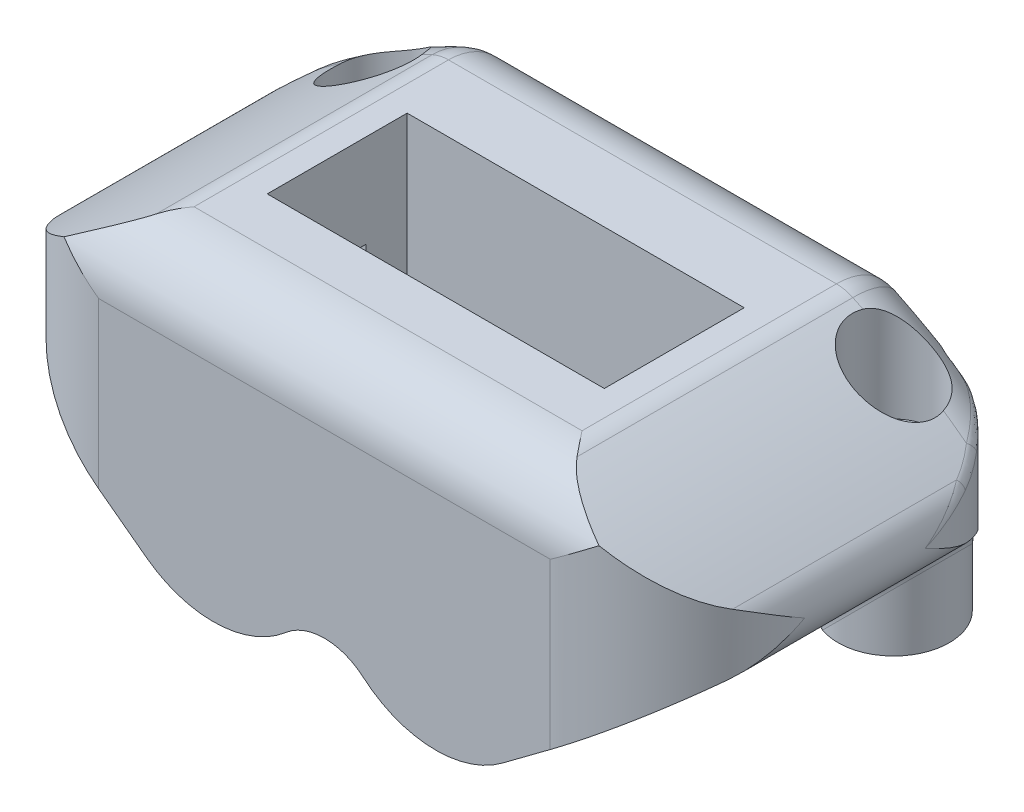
SolidWorks part; units mm, degrees
ref_plane "Plan de face" through (0, 0, 0) normal (0, 0, 1) x (1, 0, 0)
ref_plane "Plan de dessus" through (0, 0, 0) normal (0, 1, 0) x (1, 0, 0)
ref_plane "Plan de droite" through (0, 0, 0) normal (1, 0, 0) x (0, 0, -1)
sketch "Esquisse1" plane through (0, 0, 0) normal (0, 0, 1) x (1, 0, 0)
  line L0 (12.9688, 6.5) -> (99.4276, 6.5) construction
  line L1 (0, 0) -> (111, 0) construction
  line L2 (0, 0) -> (0, 45) construction
  line L4 (111, 0) -> (111, 45) construction
  line L5 (2.4153, 22.1885) -> (27.5448, 3.4665)
  line L6 (25, 45) -> (86, 45)
  line L7 (108.5847, 22.1885) -> (83.4552, 3.4665)
  arc A0 (27.5448, 3.4665) -> (49.424, 4.2432) centre (38, 17.5) ccw
  arc A1 (61.576, 4.2432) -> (83.4552, 3.4665) centre (73, 17.5) ccw
  arc A2 (2.2126, 31.6536) -> (2.4153, 22.1885) centre (6, 27) ccw
  arc A3 (108.5847, 22.1885) -> (108.7874, 31.6536) centre (105, 27) ccw
  arc A4 (61.576, 4.2432) -> (49.424, 4.2432) centre (55.5, -2.8077) ccw
  arc A5 (25, 45) -> (22.4254, 44.4195) centre (25, 39) ccw
  arc A6 (88.5746, 44.4195) -> (86, 45) centre (86, 39) ccw
  arc A7 (22.4254, 44.4195) -> (2.2126, 31.6536) centre (65.3355, -45.9061) ccw
  arc A9 (108.7874, 31.6536) -> (88.5746, 44.4195) centre (45.6645, -45.9061) ccw
  dimension "D5" = 12
  dimension "D6" = 12
  dimension "D7" = 35
  dimension "D8" = 35
  dimension "D9" = 38
  dimension "D10" = 38
  dimension "D12" = 61
  dimension "D13" = 25
  dimension "D14" = 12
  dimension "D15" = 12
  dimension "D16" = 200
  dimension "D17" = 200
  dimension "D19" = 61
  dimension "D2" = 111
  dimension "D3" = 27
  dimension "D4" = 27
  dimension "D11" = 6.5
  dimension "D18" = 45
extrude "Extrusion1" add sketch "Esquisse1" along normal blind 60
sketch "Esquisse2" plane through (0, 45, 0) normal (0, 1, 0) x (1, 0, 0)
  line L0 (-10.9198, -11.5) -> (126.3086, -11.5) construction
  line L2 (22.4254, 0) -> (2.2126, 0) construction
  line L3 (0, 0) -> (0, -60) construction
  circle A0 centre (14.5, -11.5) radius 4.15
  circle A1 centre (96.5, -11.5) radius 4.15
  dimension "D2" = 82
  dimension "D3" = 8.3
  dimension "D4" = 8.3
  dimension "D5" = 14.5
  dimension "D1" = 11.5
extrude "Extrusion2" cut sketch "Esquisse2" against normal blind 60
sketch "Esquisse3" plane through (0, 45, 0) normal (0, 1, 0) x (1, 0, 0)
  circle A0 centre (14.5, -11.5) radius 8.75
  circle A1 centre (96.5, -11.5) radius 8.75
  dimension "D1" = 17.5
  dimension "D2" = 17.5
extrude "Extrusion3" add sketch "Esquisse3" against normal blind 38.5
sketch "Esquisse4" plane through (0, 0, 0) normal (0, 0, -1) x (-1, 0, 0)
  line L4 (-108.5847, 58.5086) -> (-2.4153, 58.5086)
  line L5 (-108.5847, 58.5086) -> (-108.5847, 31.8181)
  line L6 (-25, 45) -> (-86, 45)
  line L7 (-108.5847, 22.1885) -> (-83.4552, 3.4665)
  line L8 (-27.5448, 3.4665) -> (-2.4153, 22.1885)
  line L9 (-25, 45) -> (-86, 45)
  line L13 (-2.4153, 58.5086) -> (-2.4153, 31.8181)
  arc A18 (-2.4153, 22.1885) -> (-2.2126, 31.6536) centre (-6, 27) ccw
  arc A19 (-2.2126, 31.6536) -> (-22.4254, 44.4195) centre (-65.3355, -45.9061) ccw
  arc A20 (-22.4254, 44.4195) -> (-25, 45) centre (-25, 39) ccw
  arc A21 (-86, 45) -> (-88.5746, 44.4195) centre (-86, 39) ccw
  arc A22 (-88.5746, 44.4195) -> (-108.7874, 31.6536) centre (-45.6645, -45.9061) ccw
  arc A23 (-108.7874, 31.6536) -> (-108.5847, 22.1885) centre (-105, 27) ccw
  arc A24 (-83.4552, 3.4665) -> (-61.576, 4.2432) centre (-73, 17.5) ccw
  arc A25 (-49.424, 4.2432) -> (-61.576, 4.2432) centre (-55.5, -2.8077) ccw
  arc A26 (-49.424, 4.2432) -> (-27.5448, 3.4665) centre (-38, 17.5) ccw
  arc A28 (-2.4153, 31.8181) -> (-22.4254, 44.4195) centre (-65.3355, -45.9061) ccw
  arc A29 (-22.4254, 44.4195) -> (-25, 45) centre (-25, 39) ccw
  arc A30 (-86, 45) -> (-88.5746, 44.4195) centre (-86, 39) ccw
  arc A31 (-88.5746, 44.4195) -> (-108.5847, 31.8181) centre (-45.6645, -45.9061) ccw
  dimension "D1" = 0
extrude "Extrusion4" cut sketch "Esquisse4" against normal blind 38.5
sketch "Esquisse5" plane through (0, 6.5, 0) normal (0, -1, 0) x (1, 0, 0)
  circle A0 centre (14.5, 11.5) radius 4.15
  circle A1 centre (96.5, 11.5) radius 4.15
  dimension "D1" = 8.3
  dimension "D2" = 8.3
extrude "Extrusion5" cut sketch "Esquisse5" against normal blind 38.5
sketch "Esquisse6" plane through (0, 45, 0) normal (0, 1, 0) x (1, 0, 0)
  circle A0 centre (14.5, -11.5) radius 6.5
  circle A1 centre (96.5, -11.5) radius 6.5
  dimension "D1" = 13
  dimension "D2" = 13
extrude "Extrusion6" cut sketch "Esquisse6" against normal blind 17
sketch "Esquisse7" plane through (0, 45, 0) normal (0, 1, 0) x (1, 0, 0)
  line L1 (17, 0) -> (94, 0)
  line L2 (0, -21.0263) -> (0, -40)
  line L3 (20, -60) -> (91, -60)
  line L4 (111, -21.0263) -> (111, -40)
  line L5 (-53.5355, 54.9463) -> (239.7339, 54.9463)
  line L6 (-53.5355, 54.9463) -> (-53.5355, -122.1099)
  line L7 (-53.5355, -122.1099) -> (239.7339, -122.1099)
  line L8 (239.7339, 54.9463) -> (239.7339, -122.1099)
  arc A0 (14.5, -2.5) -> (10, -3.7058) centre (14.5, -11.5) ccw
  arc A1 (101, -3.7058) -> (96.5, -2.5) centre (96.5, -11.5) ccw
  arc A2 (14.5, -2.5) -> (17, 0) centre (14.5, 0) ccw
  arc A3 (94, 0) -> (96.5, -2.5) centre (96.5, 0) ccw
  arc A4 (10, -3.7058) -> (0, -21.0263) centre (20, -21.0263) ccw
  arc A5 (111, -21.0263) -> (101, -3.7058) centre (91, -21.0263) ccw
  arc A6 (20, -60) -> (0, -40) centre (20, -40) cw
  arc A7 (111, -40) -> (91, -60) centre (91, -40) cw
  point P24 (111, -60)
  dimension "D1" = 18
  dimension "D2" = 18
  dimension "D3" = 40
  dimension "D4" = 40
  dimension "D6" = 20
  dimension "D5" = 111
  dimension "D7" = 60
extrude "Extrusion7" cut sketch "Esquisse7" against normal blind 67
fillet "Congé1" radius 10 5 edges at (91.3085, 43.0693, 0) (87.3196, 44.8531, 0) (19.6915, 43.0693, 0) (23.6804, 44.8531, 0) (55.5, 45, 0)
fillet "Congé3" radius 10 1 edges at (55.5, 45, 60)
fillet "Congé4" radius 2 12 edges at (0.3913, 29.1314, 17.0892) (6.4459, 34.0447, 6.3196) (12.2821, 35.1995, 2.7776) (16.1584, 36.3362, 1.8708) (110.6087, 29.1314, 17.0892) (105.7378, 33.6432, 7.5061) (98.7602, 35.1854, 2.7884) (94.9574, 36.4213, 1.9673) (17, 20.6677, 0) (94, 20.6677, 0)
fillet "Congé5" radius 3 2 edges at (5.75, 19.7041, 11.5) (105.25, 19.7041, 11.5)
ref_plane "Plan1" through (0, 0, 31.5) normal (0, 0, 1) x (1, 0, 0)
sketch "Esquisse8" plane through (0, 0, 31.5) normal (0, 0, 1) x (1, 0, 0)
  line L0 (55.5, 6.5) -> (55.5, -63.9268) construction
  line L1 (-28.4112, 33) -> (142.2631, 33) construction
  line L2 (25, 45) -> (86, 45) construction
  line L3 (-64.8294, 0) -> (166.7375, 0) construction
  arc A0 (61.576, 4.2432) -> (49.424, 4.2432) centre (55.5, -2.8077) ccw construction
  arc A1 (27.5448, 3.4665) -> (49.424, 4.2432) centre (38, 17.5) ccw construction
  circle A2 centre (55.5, -102) radius 135
  dimension "D2" = 270
  dimension "D1" = 12
extrude "Extrusion8" cut sketch "Esquisse8" against normal mid plane 9
sketch "Esquisse9" plane through (0, 45, 0) normal (0, 1, 0) x (1, 0, 0)
  line L0 (-11.1506, -31.5) -> (131.499, -31.5) construction
  line L1 (29, -20.5) -> (82, -20.5)
  line L2 (29, -20.5) -> (29, -42.5)
  line L3 (29, -42.5) -> (82, -42.5)
  line L4 (82, -20.5) -> (82, -42.5)
  line L5 (0, -21.0263) -> (0, -40) construction
  line L6 (25.9121, 0) -> (85.0879, 0) construction
  dimension "D1" = 31.5
  dimension "D2" = 11
  dimension "D3" = 22
  dimension "D4" = 53
  dimension "D5" = 29
extrude "Extrusion9" cut sketch "Esquisse9" against normal blind 62.5
